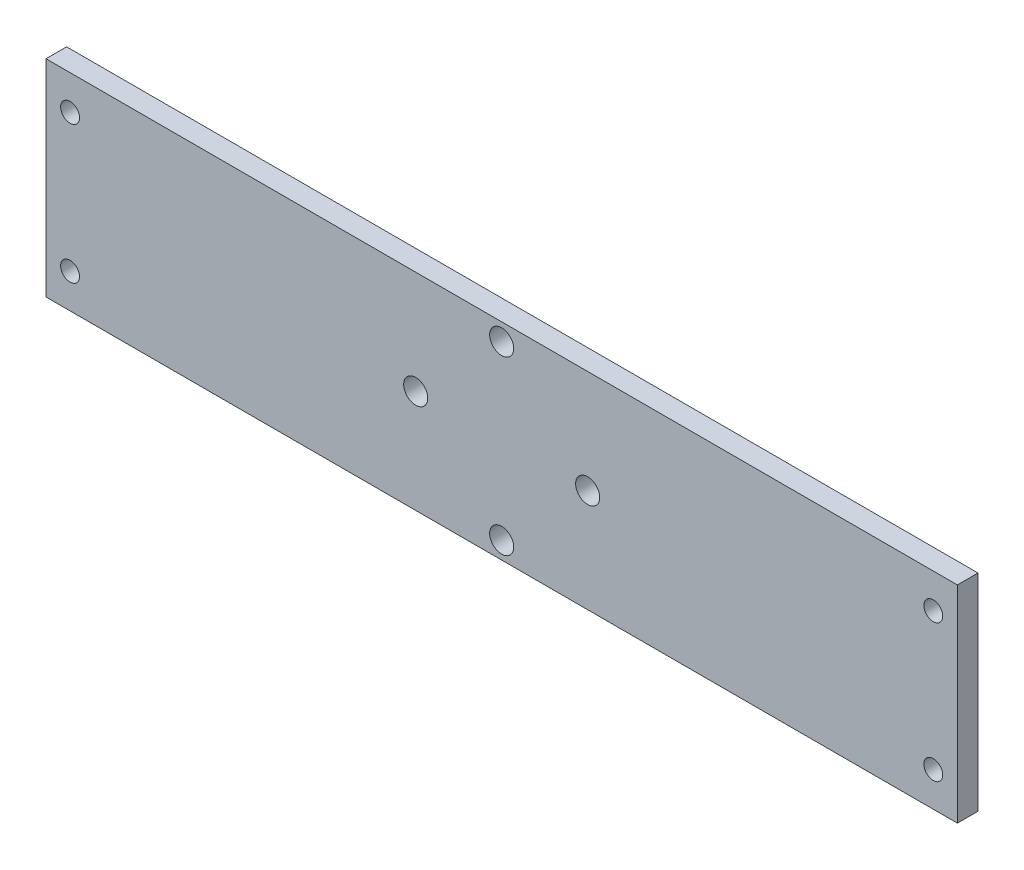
SolidWorks part; units mm, degrees
ref_plane "Front Plane" through (0, 0, 0) normal (0, 0, 1) x (1, 0, 0)
ref_plane "Top Plane" through (0, 0, 0) normal (0, 1, 0) x (1, 0, 0)
ref_plane "Right Plane" through (0, 0, 0) normal (1, 0, 0) x (0, 0, -1)
sketch "Sketch1" plane through (0, 0, 0) normal (0, 0, 1) x (1, 0, 0)
  line L0 (0, -1000) -> (0, 49000) construction
  line L1 (-132.5, 30) -> (132.5, 30)
  line L2 (-132.5, 30) -> (-132.5, -30)
  line L3 (-132.5, -30) -> (132.5, -30)
  line L4 (132.5, 30) -> (132.5, -30)
  line L5 (-132.5, 30) -> (132.5, -30) construction
  line L6 (-132.5, -30) -> (132.5, 30) construction
  line L7 (-1000, 0) -> (49000, 0) construction
  line L8 (-125.5, 180.5265) -> (-125.5, -85.2328) construction
  line L9 (125.5, 180.5265) -> (125.5, -85.2328) construction
  circle A0 centre (-125.5, 20) radius 2.75
  circle A1 centre (-125.5, -20) radius 2.75
  circle A2 centre (125.5, -20) radius 2.75
  circle A3 centre (125.5, 20) radius 2.75
  circle A4 centre (0, 0) radius 25 construction
  circle A5 centre (0, 25) radius 3.5
  circle A6 centre (25, 0) radius 3.5
  circle A7 centre (0, -25) radius 3.5
  circle A8 centre (-25, 0) radius 3.5
  point P0 (0, 0)
  point P13 (-125.5, 47.6468)
  point P36 (0, 0)
  dimension "D4" = 5.5
  dimension "D6" = 50
  dimension "D7" = 7
  dimension "D1" = 265
  dimension "D2" = 60
  dimension "D3" = 7
  dimension "D5" = 10
  dimension "D8" = 4
extrude "Boss-Extrude1" add sketch "Sketch1" along normal blind 6
